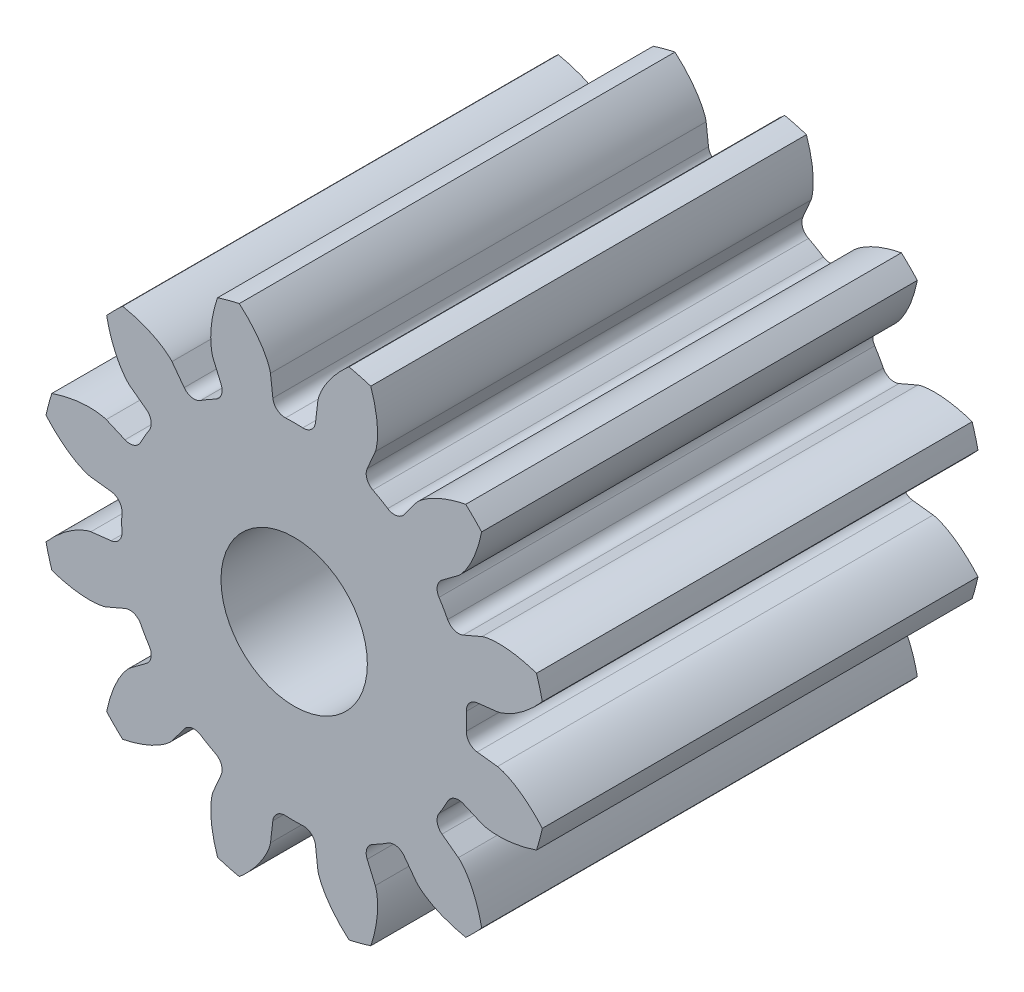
SolidWorks part; units mm, degrees
ref_plane "Front Plane" through (0, 0, 0) normal (0, 0, 1) x (1, 0, 0)
ref_plane "Top Plane" through (0, 0, 0) normal (0, 1, 0) x (1, 0, 0)
ref_plane "Right Plane" through (0, 0, 0) normal (1, 0, 0) x (0, 0, -1)
sketch "Sketch1" plane through (0, 0, 0) normal (0, 0, 1) x (1, 0, 0)
  line L0 (0, 0) -> (0, 6.35) construction
  line L1 (-2.0409, 7.0928) -> (2.0409, 5.6072) construction
  circle A0 centre (0, 0) radius 5.0271 construction
  circle A1 centre (0, 0) radius 7.4083 construction
  circle A2 centre (0, 0) radius 6.35 construction
  circle A3 centre (0, 0) radius 5.967 construction
  circle A4 centre (0, 0) radius 2.3813 construction
  circle A5 centre (0, 0) radius 4.826 construction
  point P8 (304.8, 0)
  point P13 (152.4, 0)
sketch "Sketch2" plane through (0, 0, 0) normal (1, 0, 0) x (0, 0, -1)
  line L0 (-6.35, 0) -> (6.35, 0) construction
  line L1 (-6.35, 7.4083) -> (6.35, 7.4083) construction
  point P2 (0, 7.4083)
  point P4 (0, 0)
  point P6 (0, 7.4083)
  dimension "Overall Width" = 12.7
  dimension "Hub Width" = 6.35
  dimension "Face Width" = 6.35
sketch "Sketch3" plane through (0, 0, 0) normal (0, 0, 1) x (1, 0, 0)
  circle A0 centre (0, 0) radius 7.4083
  circle A1 centre (0, 0) radius 7.4083 construction
extrude "Boss-Extrude1" add sketch "Sketch3" against normal up to vertex (6.35 mm away) and the other way up to vertex (6.35 mm away)
sketch "Sketch5" plane through (0, 0, 0) normal (1, 0, 0) x (0, 0, -1)
  line L1 (-6.35, 7.4083) -> (0, 7.4083)
  line L2 (-6.35, 7.4083) -> (-6.35, 4.826)
  line L3 (-6.35, 4.826) -> (0, 4.826)
  line L4 (0, 7.4083) -> (0, 4.826)
  line L11 (6.35, 2.3813) -> (-6.35, 2.3812)
  line L12 (6.35, 2.3813) -> (6.35, 0)
  line L13 (6.35, 0) -> (-6.35, 0)
  line L14 (-6.35, 2.3812) -> (-6.35, 0)
  point P5 (0, 2.3813)
  point P12 (0, 4.826)
revolve "Cut-Revolve1" cut sketch "Sketch5" angle 360 about L0
sketch "Sketch4" plane through (0, 0, 0) normal (0, 0, 1) x (1, 0, 0)
  line L0 (0, 0) -> (4.9933, 0.5818) construction
  line L2 (0, 0) -> (4.9933, -0.5818) construction
  line L4 (4.9933, 0.5818) -> (5.927, 0.6906)
  line L5 (5.927, -0.6906) -> (4.9933, -0.5818)
  arc A0 (4.9933, 0.5818) -> (4.9933, -0.5818) centre (0, 0) cw
  arc A3 (7.2339, 1.5983) -> (7.2339, -1.5983) centre (0, 0) cw
  circle A4 centre (0, 0) radius 7.4083 construction
  spline S0 degree 4 poles (5.927, 0.6906) (5.9293, 0.6909) (5.9359, 0.6919) (5.9484, 0.6942) (5.9686, 0.6987) (5.9942, 0.7052) (6.0271, 0.7148) (6.0655, 0.7275) (6.1073, 0.7428) (6.1523, 0.761) (6.1969, 0.7804) (6.2409, 0.8011) (6.2844, 0.8228) (6.3367, 0.8503) (6.3986, 0.8852) (6.47, 0.9285) (6.5497, 0.9807) (6.6294, 1.0371) (6.7066, 1.0952) (6.7832, 1.1568) (6.8562, 1.2185) (6.9304, 1.2856) (6.9981, 1.3489) (7.0721, 1.4232) (7.1312, 1.484) (7.2071, 1.5675) (7.2513, 1.6179) (7.3023, 1.6779) (7.3245, 1.7051) (7.3382, 1.7219) knots 0 0 0 0 0 0.005377 0.015084 0.028532 0.04661 0.064855 0.092111 0.119476 0.146842 0.174209 0.201575 0.228941 0.256307 0.307035 0.361767 0.4165 0.471232 0.525964 0.580697 0.635429 0.690161 0.744894 0.799626 0.854358 0.909091 0.954545 1 1 1 1 1 construction
  spline S1 degree 4 poles (5.927, 0.6906) (5.9293, 0.6909) (5.9359, 0.6919) (5.9484, 0.6942) (5.9686, 0.6987) (5.9942, 0.7052) (6.0271, 0.7148) (6.0655, 0.7275) (6.1073, 0.7428) (6.1523, 0.761) (6.1969, 0.7804) (6.2409, 0.8011) (6.2844, 0.8228) (6.3367, 0.8503) (6.3986, 0.8852) (6.47, 0.9285) (6.5497, 0.9807) (6.6294, 1.0371) (6.7066, 1.0952) (6.7832, 1.1568) (6.8562, 1.2185) (6.9304, 1.2856) (6.9981, 1.3489) (7.0721, 1.4232) (7.1312, 1.484) (7.1906, 1.5494) (7.2193, 1.5816) (7.2339, 1.5983) knots 0 0 0 0 0 0.005377 0.015084 0.028532 0.04661 0.064855 0.092111 0.119476 0.146842 0.174209 0.201575 0.228941 0.256307 0.307035 0.361767 0.4165 0.471232 0.525964 0.580697 0.635429 0.690161 0.744894 0.799626 0.854358 0.909091 0.909091 0.909091 0.909091 0.909091
  spline S2 degree 4 poles (5.927, -0.6906) (5.9293, -0.6909) (5.9359, -0.6919) (5.9484, -0.6942) (5.9686, -0.6987) (5.9942, -0.7052) (6.0271, -0.7148) (6.0655, -0.7275) (6.1073, -0.7428) (6.1523, -0.761) (6.1969, -0.7804) (6.2409, -0.8011) (6.2844, -0.8228) (6.3367, -0.8503) (6.3986, -0.8852) (6.47, -0.9285) (6.5497, -0.9807) (6.6294, -1.0371) (6.7066, -1.0952) (6.7832, -1.1568) (6.8562, -1.2185) (6.9304, -1.2856) (6.9981, -1.3489) (7.0721, -1.4232) (7.1312, -1.484) (7.2071, -1.5675) (7.2513, -1.6179) (7.3023, -1.6779) (7.3245, -1.7051) (7.3382, -1.7219) knots 0 0 0 0 0 0.005377 0.015084 0.028532 0.04661 0.064855 0.092111 0.119476 0.146842 0.174209 0.201575 0.228941 0.256307 0.307035 0.361767 0.4165 0.471232 0.525964 0.580697 0.635429 0.690161 0.744894 0.799626 0.854358 0.909091 0.954545 1 1 1 1 1 construction
  spline S3 degree 4 poles (5.927, -0.6906) (5.9293, -0.6909) (5.9359, -0.6919) (5.9484, -0.6942) (5.9686, -0.6987) (5.9942, -0.7052) (6.0271, -0.7148) (6.0655, -0.7275) (6.1073, -0.7428) (6.1523, -0.761) (6.1969, -0.7804) (6.2409, -0.8011) (6.2844, -0.8228) (6.3367, -0.8503) (6.3986, -0.8852) (6.47, -0.9285) (6.5497, -0.9807) (6.6294, -1.0371) (6.7066, -1.0952) (6.7832, -1.1568) (6.8562, -1.2185) (6.9304, -1.2856) (6.9981, -1.3489) (7.0721, -1.4232) (7.1312, -1.484) (7.1906, -1.5494) (7.2193, -1.5816) (7.2339, -1.5983) knots 0 0 0 0 0 0.005377 0.015084 0.028532 0.04661 0.064855 0.092111 0.119476 0.146842 0.174209 0.201575 0.228941 0.256307 0.307035 0.361767 0.4165 0.471232 0.525964 0.580697 0.635429 0.690161 0.744894 0.799626 0.854358 0.909091 0.909091 0.909091 0.909091 0.909091
extrude "Cut-Extrude1" cut sketch "Sketch4" against normal through all both and the other way through all
fillet "Fillet1" radius 0.3551 2 edges at (4.9933, -0.5818, -3.175) (4.9933, 0.5818, -3.175)
pattern_circular "CirPattern1" count 12 over 360 about axis through (0, 0, 6.35) along (0, 0, -1) of "Cut-Extrude1", "Fillet1"
sketch "Sketch6" plane through (0, 0, 6.35) normal (0, 0, 1) x (1, 0, 0)
  circle A0 centre (0, 0) radius 9.1604
extrude "Cut-Extrude2" cut sketch "Sketch6" against normal up to surface (6.35 mm away)
scale "Scale1" scale about centroid uniform scaling yes scale factor 1.5
sketch "Sketch13" plane through (0, 0, -7.9375) normal (0, 0, -1) x (-1, 0, 0)
  circle A0 centre (0, 0) radius 14.2875
  dimension "D1" = 28.575
sketch "Sketch14" plane through (0, 0, -7.9375) normal (0, 0, -1) x (-1, 0, 0)
  line L24 (-5.3423, -7.1814) -> (-4.8082, -6.4634)
  line L25 (-3.1933, -7.3957) -> (-3.5481, -8.2173)
  line L26 (-1.0359, -8.8904) -> (-0.9323, -8.0015)
  line L27 (0.9323, -8.0015) -> (1.0359, -8.8904)
  line L28 (3.5481, -8.2173) -> (3.1933, -7.3957)
  line L29 (4.8082, -6.4634) -> (5.3423, -7.1814)
  line L30 (7.1814, -5.3423) -> (6.4634, -4.8082)
  line L31 (7.3957, -3.1933) -> (8.2173, -3.5481)
  line L32 (8.8904, -1.0359) -> (8.0015, -0.9323)
  line L33 (8.0015, 0.9323) -> (8.8904, 1.0359)
  line L34 (8.2173, 3.5481) -> (7.3957, 3.1933)
  line L35 (6.4634, 4.8082) -> (7.1814, 5.3423)
  line L36 (5.3423, 7.1814) -> (4.8082, 6.4634)
  line L37 (3.1933, 7.3957) -> (3.5481, 8.2173)
  line L38 (1.0359, 8.8904) -> (0.9323, 8.0015)
  line L39 (-0.9323, 8.0015) -> (-1.0359, 8.8904)
  line L40 (-3.5481, 8.2173) -> (-3.1933, 7.3957)
  line L41 (-4.8082, 6.4634) -> (-5.3423, 7.1814)
  line L42 (-7.1814, 5.3423) -> (-6.4634, 4.8082)
  line L43 (-7.3957, 3.1933) -> (-8.2173, 3.5481)
  line L44 (-8.8904, 1.0359) -> (-8.0015, 0.9323)
  line L45 (-8.0015, -0.9323) -> (-8.8904, -1.0359)
  line L46 (-8.2173, -3.5481) -> (-7.3957, -3.1933)
  line L47 (-6.4634, -4.8082) -> (-7.1814, -5.3423)
  line L48 (-5.3423, -7.1814) -> (-4.8082, -6.4634)
  line L49 (-3.1933, -7.3957) -> (-3.5481, -8.2173)
  line L50 (-1.0359, -8.8904) -> (-0.9323, -8.0015)
  line L51 (0.9323, -8.0015) -> (1.0359, -8.8904)
  line L52 (3.5481, -8.2173) -> (3.1933, -7.3957)
  line L53 (4.8082, -6.4634) -> (5.3423, -7.1814)
  line L54 (7.1814, -5.3423) -> (6.4634, -4.8082)
  line L55 (7.3957, -3.1933) -> (8.2173, -3.5481)
  line L56 (8.8904, -1.0359) -> (8.0015, -0.9323)
  line L57 (8.0015, 0.9323) -> (8.8904, 1.0359)
  line L58 (8.2173, 3.5481) -> (7.3957, 3.1933)
  line L59 (6.4634, 4.8082) -> (7.1814, 5.3423)
  line L60 (5.3423, 7.1814) -> (4.8082, 6.4634)
  line L61 (3.1933, 7.3957) -> (3.5481, 8.2173)
  line L62 (1.0359, 8.8904) -> (0.9323, 8.0015)
  line L63 (-0.9323, 8.0015) -> (-1.0359, 8.8904)
  line L64 (-3.5481, 8.2173) -> (-3.1933, 7.3957)
  line L65 (-4.8082, 6.4634) -> (-5.3423, 7.1814)
  line L66 (-7.1814, 5.3423) -> (-6.4634, 4.8082)
  line L67 (-7.3957, 3.1933) -> (-8.2173, 3.5481)
  line L68 (-8.8904, 1.0359) -> (-8.0015, 0.9323)
  line L69 (-8.0015, -0.9323) -> (-8.8904, -1.0359)
  line L70 (-8.2173, -3.5481) -> (-7.3957, -3.1933)
  line L71 (-6.4634, -4.8082) -> (-7.1814, -5.3423)
  circle A0 centre (0, 0) radius 3.5719
  circle A1 centre (0, 0) radius 3.5719 construction
  arc A48 (-8.1984, -7.5016) -> (-7.5016, -8.1984) centre (0, 0) ccw
  arc A49 (-4.0918, -6.3339) -> (-4.8082, -6.4634) centre (-4.3808, -6.7813) ccw
  arc A50 (-4.0918, -6.3339) -> (-3.4394, -6.7106) centre (0, 0) ccw
  arc A51 (-3.1933, -7.3957) -> (-3.4394, -6.7106) centre (-3.6823, -7.1845) ccw
  arc A52 (-3.3492, -10.5958) -> (-2.3974, -10.8508) centre (0, 0) ccw
  arc A53 (-0.3767, -7.5312) -> (-0.9323, -8.0015) centre (-0.4033, -8.0632) ccw
  arc A54 (-0.3767, -7.5312) -> (0.3767, -7.5312) centre (0, 0) ccw
  arc A55 (0.9323, -8.0015) -> (0.3767, -7.5312) centre (0.4033, -8.0632) ccw
  arc A56 (2.3974, -10.8508) -> (3.3492, -10.5958) centre (0, 0) ccw
  arc A57 (3.4394, -6.7106) -> (3.1933, -7.3957) centre (3.6823, -7.1845) ccw
  arc A58 (3.4394, -6.7106) -> (4.0918, -6.3339) centre (0, 0) ccw
  arc A59 (4.8082, -6.4634) -> (4.0918, -6.3339) centre (4.3808, -6.7813) ccw
  arc A60 (7.5016, -8.1984) -> (8.1984, -7.5016) centre (0, 0) ccw
  arc A61 (6.3339, -4.0918) -> (6.4634, -4.8082) centre (6.7813, -4.3808) ccw
  arc A62 (6.3339, -4.0918) -> (6.7106, -3.4394) centre (0, 0) ccw
  arc A63 (7.3957, -3.1933) -> (6.7106, -3.4394) centre (7.1845, -3.6823) ccw
  arc A64 (10.5958, -3.3492) -> (10.8508, -2.3974) centre (0, 0) ccw
  arc A65 (7.5312, -0.3767) -> (8.0015, -0.9323) centre (8.0632, -0.4033) ccw
  arc A66 (7.5312, -0.3767) -> (7.5312, 0.3767) centre (0, 0) ccw
  arc A67 (8.0015, 0.9323) -> (7.5312, 0.3767) centre (8.0632, 0.4033) ccw
  arc A68 (10.8508, 2.3974) -> (10.5958, 3.3492) centre (0, 0) ccw
  arc A69 (6.7106, 3.4394) -> (7.3957, 3.1933) centre (7.1845, 3.6823) ccw
  arc A70 (6.7106, 3.4394) -> (6.3339, 4.0918) centre (0, 0) ccw
  arc A71 (6.4634, 4.8082) -> (6.3339, 4.0918) centre (6.7813, 4.3808) ccw
  arc A72 (8.1984, 7.5016) -> (7.5016, 8.1984) centre (0, 0) ccw
  arc A73 (4.0918, 6.3339) -> (4.8082, 6.4634) centre (4.3808, 6.7813) ccw
  arc A74 (4.0918, 6.3339) -> (3.4394, 6.7106) centre (0, 0) ccw
  arc A75 (3.1933, 7.3957) -> (3.4394, 6.7106) centre (3.6823, 7.1845) ccw
  arc A76 (3.3492, 10.5958) -> (2.3974, 10.8508) centre (0, 0) ccw
  arc A77 (0.3767, 7.5312) -> (0.9323, 8.0015) centre (0.4033, 8.0632) ccw
  arc A78 (0.3767, 7.5312) -> (-0.3767, 7.5312) centre (0, 0) ccw
  arc A79 (-0.9323, 8.0015) -> (-0.3767, 7.5312) centre (-0.4033, 8.0632) ccw
  arc A80 (-2.3974, 10.8508) -> (-3.3492, 10.5958) centre (0, 0) ccw
  arc A81 (-3.4394, 6.7106) -> (-3.1933, 7.3957) centre (-3.6823, 7.1845) ccw
  arc A82 (-3.4394, 6.7106) -> (-4.0918, 6.3339) centre (0, 0) ccw
  arc A83 (-4.8082, 6.4634) -> (-4.0918, 6.3339) centre (-4.3808, 6.7813) ccw
  arc A84 (-7.5016, 8.1984) -> (-8.1984, 7.5016) centre (0, 0) ccw
  arc A85 (-6.3339, 4.0918) -> (-6.4634, 4.8082) centre (-6.7813, 4.3808) ccw
  arc A86 (-6.3339, 4.0918) -> (-6.7106, 3.4394) centre (0, 0) ccw
  arc A87 (-7.3957, 3.1933) -> (-6.7106, 3.4394) centre (-7.1845, 3.6823) ccw
  arc A88 (-10.5958, 3.3492) -> (-10.8508, 2.3974) centre (0, 0) ccw
  arc A89 (-7.5312, 0.3767) -> (-8.0015, 0.9323) centre (-8.0632, 0.4033) ccw
  arc A90 (-7.5312, 0.3767) -> (-7.5312, -0.3767) centre (0, 0) ccw
  arc A91 (-8.0015, -0.9323) -> (-7.5312, -0.3767) centre (-8.0632, -0.4033) ccw
  arc A92 (-10.8508, -2.3974) -> (-10.5958, -3.3492) centre (0, 0) ccw
  arc A93 (-6.7106, -3.4394) -> (-7.3957, -3.1933) centre (-7.1845, -3.6823) ccw
  arc A94 (-6.7106, -3.4394) -> (-6.3339, -4.0918) centre (0, 0) ccw
  arc A95 (-6.4634, -4.8082) -> (-6.3339, -4.0918) centre (-6.7813, -4.3808) ccw
  arc A96 (-8.1984, -7.5016) -> (-7.5016, -8.1984) centre (0, 0) ccw
  arc A97 (-4.0918, -6.3339) -> (-4.8082, -6.4634) centre (-4.3808, -6.7813) ccw
  arc A98 (-4.0918, -6.3339) -> (-3.4394, -6.7106) centre (0, 0) ccw
  arc A99 (-3.1933, -7.3957) -> (-3.4394, -6.7106) centre (-3.6823, -7.1845) ccw
  arc A100 (-3.3492, -10.5958) -> (-2.3974, -10.8508) centre (0, 0) ccw
  arc A101 (-0.3767, -7.5312) -> (-0.9323, -8.0015) centre (-0.4033, -8.0632) ccw
  arc A102 (-0.3767, -7.5312) -> (0.3767, -7.5312) centre (0, 0) ccw
  arc A103 (0.9323, -8.0015) -> (0.3767, -7.5312) centre (0.4033, -8.0632) ccw
  arc A104 (2.3974, -10.8508) -> (3.3492, -10.5958) centre (0, 0) ccw
  arc A105 (3.4394, -6.7106) -> (3.1933, -7.3957) centre (3.6823, -7.1845) ccw
  arc A106 (3.4394, -6.7106) -> (4.0918, -6.3339) centre (0, 0) ccw
  arc A107 (4.8082, -6.4634) -> (4.0918, -6.3339) centre (4.3808, -6.7813) ccw
  arc A108 (7.5016, -8.1984) -> (8.1984, -7.5016) centre (0, 0) ccw
  arc A109 (6.3339, -4.0918) -> (6.4634, -4.8082) centre (6.7813, -4.3808) ccw
  arc A110 (6.3339, -4.0918) -> (6.7106, -3.4394) centre (0, 0) ccw
  arc A111 (7.3957, -3.1933) -> (6.7106, -3.4394) centre (7.1845, -3.6823) ccw
  arc A112 (10.5958, -3.3492) -> (10.8508, -2.3974) centre (0, 0) ccw
  arc A113 (7.5312, -0.3767) -> (8.0015, -0.9323) centre (8.0632, -0.4033) ccw
  arc A114 (7.5312, -0.3767) -> (7.5312, 0.3767) centre (0, 0) ccw
  arc A115 (8.0015, 0.9323) -> (7.5312, 0.3767) centre (8.0632, 0.4033) ccw
  arc A116 (10.8508, 2.3974) -> (10.5958, 3.3492) centre (0, 0) ccw
  arc A117 (6.7106, 3.4394) -> (7.3957, 3.1933) centre (7.1845, 3.6823) ccw
  arc A118 (6.7106, 3.4394) -> (6.3339, 4.0918) centre (0, 0) ccw
  arc A119 (6.4634, 4.8082) -> (6.3339, 4.0918) centre (6.7813, 4.3808) ccw
  arc A120 (8.1984, 7.5016) -> (7.5016, 8.1984) centre (0, 0) ccw
  arc A121 (4.0918, 6.3339) -> (4.8082, 6.4634) centre (4.3808, 6.7813) ccw
  arc A122 (4.0918, 6.3339) -> (3.4394, 6.7106) centre (0, 0) ccw
  arc A123 (3.1933, 7.3957) -> (3.4394, 6.7106) centre (3.6823, 7.1845) ccw
  arc A124 (3.3492, 10.5958) -> (2.3974, 10.8508) centre (0, 0) ccw
  arc A125 (0.3767, 7.5312) -> (0.9323, 8.0015) centre (0.4033, 8.0632) ccw
  arc A126 (0.3767, 7.5312) -> (-0.3767, 7.5312) centre (0, 0) ccw
  arc A127 (-0.9323, 8.0015) -> (-0.3767, 7.5312) centre (-0.4033, 8.0632) ccw
  arc A128 (-2.3974, 10.8508) -> (-3.3492, 10.5958) centre (0, 0) ccw
  arc A129 (-3.4394, 6.7106) -> (-3.1933, 7.3957) centre (-3.6823, 7.1845) ccw
  arc A130 (-3.4394, 6.7106) -> (-4.0918, 6.3339) centre (0, 0) ccw
  arc A131 (-4.8082, 6.4634) -> (-4.0918, 6.3339) centre (-4.3808, 6.7813) ccw
  arc A132 (-7.5016, 8.1984) -> (-8.1984, 7.5016) centre (0, 0) ccw
  arc A133 (-6.3339, 4.0918) -> (-6.4634, 4.8082) centre (-6.7813, 4.3808) ccw
  arc A134 (-6.3339, 4.0918) -> (-6.7106, 3.4394) centre (0, 0) ccw
  arc A135 (-7.3957, 3.1933) -> (-6.7106, 3.4394) centre (-7.1845, 3.6823) ccw
  arc A136 (-10.5958, 3.3492) -> (-10.8508, 2.3974) centre (0, 0) ccw
  arc A137 (-7.5312, 0.3767) -> (-8.0015, 0.9323) centre (-8.0632, 0.4033) ccw
  arc A138 (-7.5312, 0.3767) -> (-7.5312, -0.3767) centre (0, 0) ccw
  arc A139 (-8.0015, -0.9323) -> (-7.5312, -0.3767) centre (-8.0632, -0.4033) ccw
  arc A140 (-10.8508, -2.3974) -> (-10.5958, -3.3492) centre (0, 0) ccw
  arc A141 (-6.7106, -3.4394) -> (-7.3957, -3.1933) centre (-7.1845, -3.6823) ccw
  arc A142 (-6.7106, -3.4394) -> (-6.3339, -4.0918) centre (0, 0) ccw
  arc A143 (-6.4634, -4.8082) -> (-6.3339, -4.0918) centre (-6.7813, -4.3808) ccw
  spline S24 degree 4 poles (-2950.3771, -589.9369) (50.7356, 3.6642) (-11.2792, -8.8437) (-7.9522, -8.3216) (-7.1528, -8.1195) (-7.0009, -8.0791) (-6.8678, -8.0387) (-6.7251, -7.9926) (-6.5901, -7.944) (-6.4527, -7.8908) (-6.3193, -7.834) (-6.1862, -7.7727) (-6.0587, -7.7084) (-5.9489, -7.6481) (-5.8571, -7.5938) (-5.7821, -7.5467) (-5.7213, -7.5064) (-5.6615, -7.4647) (-5.6028, -7.4214) (-5.5454, -7.3765) (-5.4941, -7.3337) (-5.4489, -7.2933) (-5.4118, -7.2578) (-5.3841, -7.2295) (-5.0204, -6.8307) (-5.0047, -6.1356) (-26.8856, 10.8045) (-2387.5552, 1816.0789) knots -1.19985 -1.19985 -1.19985 -1.19985 -1.19985 0.054733 0.109465 0.164197 0.21893 0.273662 0.328394 0.383127 0.437859 0.492591 0.547324 0.602056 0.652784 0.68015 0.707516 0.734882 0.762248 0.789615 0.81698 0.844236 0.862481 0.880559 0.894007 0.903714 1.672385 1.672385 1.672385 1.672385 1.672385 only from (-7.5016, -8.1984) to (-5.3423, -7.1814)
  spline S25 degree 4 poles (2766.4875, -1159.6188) (22.7994, -17.8812) (-2.8112, -7.402) (-3.4054, -7.7631) (-3.5689, -8.2775) (-3.5795, -8.3157) (-3.5917, -8.3655) (-3.6041, -8.4249) (-3.6156, -8.4907) (-3.6258, -8.5628) (-3.6339, -8.6353) (-3.6401, -8.708) (-3.6445, -8.7808) (-3.6479, -8.8693) (-3.6491, -8.9759) (-3.6463, -9.1012) (-3.6383, -9.2438) (-3.6248, -9.3897) (-3.6073, -9.5336) (-3.5847, -9.6792) (-3.5593, -9.8204) (-3.5278, -9.9671) (-3.4963, -10.1025) (-3.4553, -10.2542) (-3.2307, -11.0476) (-2.0193, -14.1899) (-22.1946, 45.7707) (964.2953, -2850.0908) knots -0.76329 -0.76329 -0.76329 -0.76329 -0.76329 0.005377 0.015084 0.028532 0.04661 0.064855 0.092111 0.119476 0.146842 0.174209 0.201575 0.228941 0.256307 0.307035 0.361767 0.4165 0.471232 0.525964 0.580697 0.635429 0.690161 0.744894 0.799626 0.854358 2.108943 2.108943 2.108943 2.108943 2.108943 only from (-3.5481, -8.2173) to (-3.3492, -10.5958)
  spline S26 degree 4 poles (-2260.1331, -1986.0888) (42.1062, 28.5411) (-5.3462, -13.2985) (-2.726, -11.1828) (-2.1347, -10.6081) (-2.0234, -10.4972) (-1.9283, -10.3956) (-1.8278, -10.2843) (-1.7352, -10.1748) (-1.6428, -10.06) (-1.5556, -9.9441) (-1.4711, -9.8245) (-1.3928, -9.705) (-1.3278, -9.5979) (-1.2755, -9.505) (-1.2342, -9.4267) (-1.2016, -9.3614) (-1.1706, -9.2953) (-1.1414, -9.2285) (-1.1142, -9.1609) (-1.0912, -9.0982) (-1.0722, -9.0406) (-1.0579, -8.9913) (-1.048, -8.953) (-0.9324, -8.4258) (-1.2664, -7.8159) (-28.6859, -4.0858) (-2975.7229, 378.9928) knots -1.19985 -1.19985 -1.19985 -1.19985 -1.19985 0.054733 0.109465 0.164197 0.21893 0.273662 0.328394 0.383127 0.437859 0.492591 0.547324 0.602056 0.652784 0.68015 0.707516 0.734882 0.762248 0.789615 0.81698 0.844236 0.862481 0.880559 0.894007 0.903714 1.672385 1.672385 1.672385 1.672385 1.672385 only from (-2.3974, -10.8508) to (-1.0359, -8.8904)
  spline S27 degree 4 poles (2975.6578, 378.9844) (28.6854, -4.0859) (1.2664, -7.8159) (0.9324, -8.4258) (1.048, -8.953) (1.0579, -8.9913) (1.0722, -9.0406) (1.0912, -9.0982) (1.1142, -9.1609) (1.1414, -9.2285) (1.1706, -9.2953) (1.2016, -9.3614) (1.2342, -9.4267) (1.2755, -9.505) (1.3278, -9.5979) (1.3928, -9.705) (1.4711, -9.8245) (1.5556, -9.9441) (1.6428, -10.06) (1.7352, -10.1748) (1.8278, -10.2843) (1.9283, -10.3956) (2.0234, -10.4972) (2.1347, -10.6081) (2.726, -11.1828) (5.3462, -13.2985) (-42.1065, 28.5413) (2260.1496, -1986.1034) knots -0.76329 -0.76329 -0.76329 -0.76329 -0.76329 0.005377 0.015084 0.028532 0.04661 0.064855 0.092111 0.119476 0.146842 0.174209 0.201575 0.228941 0.256307 0.307035 0.361767 0.4165 0.471232 0.525964 0.580697 0.635429 0.690161 0.744894 0.799626 0.854358 2.108943 2.108943 2.108943 2.108943 2.108943 only from (1.0359, -8.8904) to (2.3974, -10.8508)
  spline S28 degree 4 poles (-964.2882, -2850.0699) (22.1945, 45.7704) (2.0193, -14.1899) (3.2307, -11.0476) (3.4553, -10.2542) (3.4963, -10.1025) (3.5278, -9.9671) (3.5593, -9.8204) (3.5847, -9.6792) (3.6073, -9.5336) (3.6248, -9.3897) (3.6383, -9.2438) (3.6463, -9.1012) (3.6491, -8.9759) (3.6479, -8.8693) (3.6445, -8.7808) (3.6401, -8.708) (3.6339, -8.6353) (3.6258, -8.5628) (3.6156, -8.4907) (3.6041, -8.4249) (3.5917, -8.3655) (3.5795, -8.3157) (3.5689, -8.2775) (3.4054, -7.7631) (2.8112, -7.402) (-22.7998, -17.8814) (-2766.5481, -1159.644) knots -1.19985 -1.19985 -1.19985 -1.19985 -1.19985 0.054733 0.109465 0.164197 0.21893 0.273662 0.328394 0.383127 0.437859 0.492591 0.547324 0.602056 0.652784 0.68015 0.707516 0.734882 0.762248 0.789615 0.81698 0.844236 0.862481 0.880559 0.894007 0.903714 1.672385 1.672385 1.672385 1.672385 1.672385 only from (3.3492, -10.5958) to (3.5481, -8.2173)
  spline S29 degree 4 poles (2387.5031, 1816.039) (26.8853, 10.8042) (5.0047, -6.1356) (5.0204, -6.8307) (5.3841, -7.2295) (5.4118, -7.2578) (5.4489, -7.2933) (5.4941, -7.3337) (5.5454, -7.3765) (5.6028, -7.4214) (5.6615, -7.4647) (5.7213, -7.5064) (5.7821, -7.5467) (5.8571, -7.5938) (5.9489, -7.6481) (6.0587, -7.7084) (6.1862, -7.7727) (6.3193, -7.834) (6.4527, -7.8908) (6.5901, -7.944) (6.7251, -7.9926) (6.8678, -8.0387) (7.0009, -8.0791) (7.1528, -8.1195) (7.9522, -8.3216) (11.2792, -8.8437) (-50.7359, 3.6643) (2950.3987, -589.9411) knots -0.76329 -0.76329 -0.76329 -0.76329 -0.76329 0.005377 0.015084 0.028532 0.04661 0.064855 0.092111 0.119476 0.146842 0.174209 0.201575 0.228941 0.256307 0.307035 0.361767 0.4165 0.471232 0.525964 0.580697 0.635429 0.690161 0.744894 0.799626 0.854358 2.108943 2.108943 2.108943 2.108943 2.108943 only from (5.3423, -7.1814) to (7.5016, -8.1984)
  spline S30 degree 4 poles (589.9369, -2950.3771) (-3.6642, 50.7356) (8.8437, -11.2792) (8.3216, -7.9522) (8.1195, -7.1528) (8.0791, -7.0009) (8.0387, -6.8678) (7.9926, -6.7251) (7.944, -6.5901) (7.8908, -6.4527) (7.834, -6.3193) (7.7727, -6.1862) (7.7084, -6.0587) (7.6481, -5.9489) (7.5938, -5.8571) (7.5467, -5.7821) (7.5064, -5.7213) (7.4647, -5.6615) (7.4214, -5.6028) (7.3765, -5.5454) (7.3337, -5.4941) (7.2933, -5.4489) (7.2578, -5.4118) (7.2295, -5.3841) (6.8307, -5.0204) (6.1356, -5.0047) (-10.8045, -26.8856) (-1816.0789, -2387.5552) knots -1.19985 -1.19985 -1.19985 -1.19985 -1.19985 0.054733 0.109465 0.164197 0.21893 0.273662 0.328394 0.383127 0.437859 0.492591 0.547324 0.602056 0.652784 0.68015 0.707516 0.734882 0.762248 0.789615 0.81698 0.844236 0.862481 0.880559 0.894007 0.903714 1.672385 1.672385 1.672385 1.672385 1.672385 only from (8.1984, -7.5016) to (7.1814, -5.3423)
  spline S31 degree 4 poles (1159.6188, 2766.4875) (17.8812, 22.7994) (7.402, -2.8112) (7.7631, -3.4054) (8.2775, -3.5689) (8.3157, -3.5795) (8.3655, -3.5917) (8.4249, -3.6041) (8.4907, -3.6156) (8.5628, -3.6258) (8.6353, -3.6339) (8.708, -3.6401) (8.7808, -3.6445) (8.8693, -3.6479) (8.9759, -3.6491) (9.1012, -3.6463) (9.2438, -3.6383) (9.3897, -3.6248) (9.5336, -3.6073) (9.6792, -3.5847) (9.8204, -3.5593) (9.9671, -3.5278) (10.1025, -3.4963) (10.2542, -3.4553) (11.0476, -3.2307) (14.1899, -2.0193) (-45.7707, -22.1946) (2850.0908, 964.2953) knots -0.76329 -0.76329 -0.76329 -0.76329 -0.76329 0.005377 0.015084 0.028532 0.04661 0.064855 0.092111 0.119476 0.146842 0.174209 0.201575 0.228941 0.256307 0.307035 0.361767 0.4165 0.471232 0.525964 0.580697 0.635429 0.690161 0.744894 0.799626 0.854358 2.108943 2.108943 2.108943 2.108943 2.108943 only from (8.2173, -3.5481) to (10.5958, -3.3492)
  spline S32 degree 4 poles (1986.0888, -2260.1331) (-28.5411, 42.1062) (13.2985, -5.3462) (11.1828, -2.726) (10.6081, -2.1347) (10.4972, -2.0234) (10.3956, -1.9283) (10.2843, -1.8278) (10.1748, -1.7352) (10.06, -1.6428) (9.9441, -1.5556) (9.8245, -1.4711) (9.705, -1.3928) (9.5979, -1.3278) (9.505, -1.2755) (9.4267, -1.2342) (9.3614, -1.2016) (9.2953, -1.1706) (9.2285, -1.1414) (9.1609, -1.1142) (9.0982, -1.0912) (9.0406, -1.0722) (8.9913, -1.0579) (8.953, -1.048) (8.4258, -0.9324) (7.8159, -1.2664) (4.0858, -28.6859) (-378.9928, -2975.7229) knots -1.19985 -1.19985 -1.19985 -1.19985 -1.19985 0.054733 0.109465 0.164197 0.21893 0.273662 0.328394 0.383127 0.437859 0.492591 0.547324 0.602056 0.652784 0.68015 0.707516 0.734882 0.762248 0.789615 0.81698 0.844236 0.862481 0.880559 0.894007 0.903714 1.672385 1.672385 1.672385 1.672385 1.672385 only from (10.8508, -2.3974) to (8.8904, -1.0359)
  spline S33 degree 4 poles (-378.9844, 2975.6578) (4.0859, 28.6854) (7.8159, 1.2664) (8.4258, 0.9324) (8.953, 1.048) (8.9913, 1.0579) (9.0406, 1.0722) (9.0982, 1.0912) (9.1609, 1.1142) (9.2285, 1.1414) (9.2953, 1.1706) (9.3614, 1.2016) (9.4267, 1.2342) (9.505, 1.2755) (9.5979, 1.3278) (9.705, 1.3928) (9.8245, 1.4711) (9.9441, 1.5556) (10.06, 1.6428) (10.1748, 1.7352) (10.2843, 1.8278) (10.3956, 1.9283) (10.4972, 2.0234) (10.6081, 2.1347) (11.1828, 2.726) (13.2985, 5.3462) (-28.5413, -42.1065) (1986.1034, 2260.1496) knots -0.76329 -0.76329 -0.76329 -0.76329 -0.76329 0.005377 0.015084 0.028532 0.04661 0.064855 0.092111 0.119476 0.146842 0.174209 0.201575 0.228941 0.256307 0.307035 0.361767 0.4165 0.471232 0.525964 0.580697 0.635429 0.690161 0.744894 0.799626 0.854358 2.108943 2.108943 2.108943 2.108943 2.108943 only from (8.8904, 1.0359) to (10.8508, 2.3974)
  spline S34 degree 4 poles (2850.0699, -964.2882) (-45.7704, 22.1945) (14.1899, 2.0193) (11.0476, 3.2307) (10.2542, 3.4553) (10.1025, 3.4963) (9.9671, 3.5278) (9.8204, 3.5593) (9.6792, 3.5847) (9.5336, 3.6073) (9.3897, 3.6248) (9.2438, 3.6383) (9.1012, 3.6463) (8.9759, 3.6491) (8.8693, 3.6479) (8.7808, 3.6445) (8.708, 3.6401) (8.6353, 3.6339) (8.5628, 3.6258) (8.4907, 3.6156) (8.4249, 3.6041) (8.3655, 3.5917) (8.3157, 3.5795) (8.2775, 3.5689) (7.7631, 3.4054) (7.402, 2.8112) (17.8814, -22.7998) (1159.644, -2766.5481) knots -1.19985 -1.19985 -1.19985 -1.19985 -1.19985 0.054733 0.109465 0.164197 0.21893 0.273662 0.328394 0.383127 0.437859 0.492591 0.547324 0.602056 0.652784 0.68015 0.707516 0.734882 0.762248 0.789615 0.81698 0.844236 0.862481 0.880559 0.894007 0.903714 1.672385 1.672385 1.672385 1.672385 1.672385 only from (10.5958, 3.3492) to (8.2173, 3.5481)
  spline S35 degree 4 poles (-1816.039, 2387.5031) (-10.8042, 26.8853) (6.1356, 5.0047) (6.8307, 5.0204) (7.2295, 5.3841) (7.2578, 5.4118) (7.2933, 5.4489) (7.3337, 5.4941) (7.3765, 5.5454) (7.4214, 5.6028) (7.4647, 5.6615) (7.5064, 5.7213) (7.5467, 5.7821) (7.5938, 5.8571) (7.6481, 5.9489) (7.7084, 6.0587) (7.7727, 6.1862) (7.834, 6.3193) (7.8908, 6.4527) (7.944, 6.5901) (7.9926, 6.7251) (8.0387, 6.8678) (8.0791, 7.0009) (8.1195, 7.1528) (8.3216, 7.9522) (8.8437, 11.2792) (-3.6643, -50.7359) (589.9411, 2950.3987) knots -0.76329 -0.76329 -0.76329 -0.76329 -0.76329 0.005377 0.015084 0.028532 0.04661 0.064855 0.092111 0.119476 0.146842 0.174209 0.201575 0.228941 0.256307 0.307035 0.361767 0.4165 0.471232 0.525964 0.580697 0.635429 0.690161 0.744894 0.799626 0.854358 2.108943 2.108943 2.108943 2.108943 2.108943 only from (7.1814, 5.3423) to (8.1984, 7.5016)
  spline S36 degree 4 poles (2950.3771, 589.9369) (-50.7356, -3.6642) (11.2792, 8.8437) (7.9522, 8.3216) (7.1528, 8.1195) (7.0009, 8.0791) (6.8678, 8.0387) (6.7251, 7.9926) (6.5901, 7.944) (6.4527, 7.8908) (6.3193, 7.834) (6.1862, 7.7727) (6.0587, 7.7084) (5.9489, 7.6481) (5.8571, 7.5938) (5.7821, 7.5467) (5.7213, 7.5064) (5.6615, 7.4647) (5.6028, 7.4214) (5.5454, 7.3765) (5.4941, 7.3337) (5.4489, 7.2933) (5.4118, 7.2578) (5.3841, 7.2295) (5.0204, 6.8307) (5.0047, 6.1356) (26.8856, -10.8045) (2387.5552, -1816.0789) knots -1.19985 -1.19985 -1.19985 -1.19985 -1.19985 0.054733 0.109465 0.164197 0.21893 0.273662 0.328394 0.383127 0.437859 0.492591 0.547324 0.602056 0.652784 0.68015 0.707516 0.734882 0.762248 0.789615 0.81698 0.844236 0.862481 0.880559 0.894007 0.903714 1.672385 1.672385 1.672385 1.672385 1.672385 only from (7.5016, 8.1984) to (5.3423, 7.1814)
  spline S37 degree 4 poles (-2766.4875, 1159.6188) (-22.7994, 17.8812) (2.8112, 7.402) (3.4054, 7.7631) (3.5689, 8.2775) (3.5795, 8.3157) (3.5917, 8.3655) (3.6041, 8.4249) (3.6156, 8.4907) (3.6258, 8.5628) (3.6339, 8.6353) (3.6401, 8.708) (3.6445, 8.7808) (3.6479, 8.8693) (3.6491, 8.9759) (3.6463, 9.1012) (3.6383, 9.2438) (3.6248, 9.3897) (3.6073, 9.5336) (3.5847, 9.6792) (3.5593, 9.8204) (3.5278, 9.9671) (3.4963, 10.1025) (3.4553, 10.2542) (3.2307, 11.0476) (2.0193, 14.1899) (22.1946, -45.7707) (-964.2953, 2850.0908) knots -0.76329 -0.76329 -0.76329 -0.76329 -0.76329 0.005377 0.015084 0.028532 0.04661 0.064855 0.092111 0.119476 0.146842 0.174209 0.201575 0.228941 0.256307 0.307035 0.361767 0.4165 0.471232 0.525964 0.580697 0.635429 0.690161 0.744894 0.799626 0.854358 2.108943 2.108943 2.108943 2.108943 2.108943 only from (3.5481, 8.2173) to (3.3492, 10.5958)
  spline S38 degree 4 poles (2260.1331, 1986.0888) (-42.1062, -28.5411) (5.3462, 13.2985) (2.726, 11.1828) (2.1347, 10.6081) (2.0234, 10.4972) (1.9283, 10.3956) (1.8278, 10.2843) (1.7352, 10.1748) (1.6428, 10.06) (1.5556, 9.9441) (1.4711, 9.8245) (1.3928, 9.705) (1.3278, 9.5979) (1.2755, 9.505) (1.2342, 9.4267) (1.2016, 9.3614) (1.1706, 9.2953) (1.1414, 9.2285) (1.1142, 9.1609) (1.0912, 9.0982) (1.0722, 9.0406) (1.0579, 8.9913) (1.048, 8.953) (0.9324, 8.4258) (1.2664, 7.8159) (28.6859, 4.0858) (2975.7229, -378.9928) knots -1.19985 -1.19985 -1.19985 -1.19985 -1.19985 0.054733 0.109465 0.164197 0.21893 0.273662 0.328394 0.383127 0.437859 0.492591 0.547324 0.602056 0.652784 0.68015 0.707516 0.734882 0.762248 0.789615 0.81698 0.844236 0.862481 0.880559 0.894007 0.903714 1.672385 1.672385 1.672385 1.672385 1.672385 only from (2.3974, 10.8508) to (1.0359, 8.8904)
  spline S39 degree 4 poles (-2975.6578, -378.9844) (-28.6854, 4.0859) (-1.2664, 7.8159) (-0.9324, 8.4258) (-1.048, 8.953) (-1.0579, 8.9913) (-1.0722, 9.0406) (-1.0912, 9.0982) (-1.1142, 9.1609) (-1.1414, 9.2285) (-1.1706, 9.2953) (-1.2016, 9.3614) (-1.2342, 9.4267) (-1.2755, 9.505) (-1.3278, 9.5979) (-1.3928, 9.705) (-1.4711, 9.8245) (-1.5556, 9.9441) (-1.6428, 10.06) (-1.7352, 10.1748) (-1.8278, 10.2843) (-1.9283, 10.3956) (-2.0234, 10.4972) (-2.1347, 10.6081) (-2.726, 11.1828) (-5.3462, 13.2985) (42.1065, -28.5413) (-2260.1496, 1986.1034) knots -0.76329 -0.76329 -0.76329 -0.76329 -0.76329 0.005377 0.015084 0.028532 0.04661 0.064855 0.092111 0.119476 0.146842 0.174209 0.201575 0.228941 0.256307 0.307035 0.361767 0.4165 0.471232 0.525964 0.580697 0.635429 0.690161 0.744894 0.799626 0.854358 2.108943 2.108943 2.108943 2.108943 2.108943 only from (-1.0359, 8.8904) to (-2.3974, 10.8508)
  spline S40 degree 4 poles (964.2882, 2850.0699) (-22.1945, -45.7704) (-2.0193, 14.1899) (-3.2307, 11.0476) (-3.4553, 10.2542) (-3.4963, 10.1025) (-3.5278, 9.9671) (-3.5593, 9.8204) (-3.5847, 9.6792) (-3.6073, 9.5336) (-3.6248, 9.3897) (-3.6383, 9.2438) (-3.6463, 9.1012) (-3.6491, 8.9759) (-3.6479, 8.8693) (-3.6445, 8.7808) (-3.6401, 8.708) (-3.6339, 8.6353) (-3.6258, 8.5628) (-3.6156, 8.4907) (-3.6041, 8.4249) (-3.5917, 8.3655) (-3.5795, 8.3157) (-3.5689, 8.2775) (-3.4054, 7.7631) (-2.8112, 7.402) (22.7998, 17.8814) (2766.5481, 1159.644) knots -1.19985 -1.19985 -1.19985 -1.19985 -1.19985 0.054733 0.109465 0.164197 0.21893 0.273662 0.328394 0.383127 0.437859 0.492591 0.547324 0.602056 0.652784 0.68015 0.707516 0.734882 0.762248 0.789615 0.81698 0.844236 0.862481 0.880559 0.894007 0.903714 1.672385 1.672385 1.672385 1.672385 1.672385 only from (-3.3492, 10.5958) to (-3.5481, 8.2173)
  spline S41 degree 4 poles (-2387.5031, -1816.039) (-26.8853, -10.8042) (-5.0047, 6.1356) (-5.0204, 6.8307) (-5.3841, 7.2295) (-5.4118, 7.2578) (-5.4489, 7.2933) (-5.4941, 7.3337) (-5.5454, 7.3765) (-5.6028, 7.4214) (-5.6615, 7.4647) (-5.7213, 7.5064) (-5.7821, 7.5467) (-5.8571, 7.5938) (-5.9489, 7.6481) (-6.0587, 7.7084) (-6.1862, 7.7727) (-6.3193, 7.834) (-6.4527, 7.8908) (-6.5901, 7.944) (-6.7251, 7.9926) (-6.8678, 8.0387) (-7.0009, 8.0791) (-7.1528, 8.1195) (-7.9522, 8.3216) (-11.2792, 8.8437) (50.7359, -3.6643) (-2950.3987, 589.9411) knots -0.76329 -0.76329 -0.76329 -0.76329 -0.76329 0.005377 0.015084 0.028532 0.04661 0.064855 0.092111 0.119476 0.146842 0.174209 0.201575 0.228941 0.256307 0.307035 0.361767 0.4165 0.471232 0.525964 0.580697 0.635429 0.690161 0.744894 0.799626 0.854358 2.108943 2.108943 2.108943 2.108943 2.108943 only from (-5.3423, 7.1814) to (-7.5016, 8.1984)
  spline S42 degree 4 poles (-589.9369, 2950.3771) (3.6642, -50.7356) (-8.8437, 11.2792) (-8.3216, 7.9522) (-8.1195, 7.1528) (-8.0791, 7.0009) (-8.0387, 6.8678) (-7.9926, 6.7251) (-7.944, 6.5901) (-7.8908, 6.4527) (-7.834, 6.3193) (-7.7727, 6.1862) (-7.7084, 6.0587) (-7.6481, 5.9489) (-7.5938, 5.8571) (-7.5467, 5.7821) (-7.5064, 5.7213) (-7.4647, 5.6615) (-7.4214, 5.6028) (-7.3765, 5.5454) (-7.3337, 5.4941) (-7.2933, 5.4489) (-7.2578, 5.4118) (-7.2295, 5.3841) (-6.8307, 5.0204) (-6.1356, 5.0047) (10.8045, 26.8856) (1816.0789, 2387.5552) knots -1.19985 -1.19985 -1.19985 -1.19985 -1.19985 0.054733 0.109465 0.164197 0.21893 0.273662 0.328394 0.383127 0.437859 0.492591 0.547324 0.602056 0.652784 0.68015 0.707516 0.734882 0.762248 0.789615 0.81698 0.844236 0.862481 0.880559 0.894007 0.903714 1.672385 1.672385 1.672385 1.672385 1.672385 only from (-8.1984, 7.5016) to (-7.1814, 5.3423)
  spline S43 degree 4 poles (-1159.6188, -2766.4875) (-17.8812, -22.7994) (-7.402, 2.8112) (-7.7631, 3.4054) (-8.2775, 3.5689) (-8.3157, 3.5795) (-8.3655, 3.5917) (-8.4249, 3.6041) (-8.4907, 3.6156) (-8.5628, 3.6258) (-8.6353, 3.6339) (-8.708, 3.6401) (-8.7808, 3.6445) (-8.8693, 3.6479) (-8.9759, 3.6491) (-9.1012, 3.6463) (-9.2438, 3.6383) (-9.3897, 3.6248) (-9.5336, 3.6073) (-9.6792, 3.5847) (-9.8204, 3.5593) (-9.9671, 3.5278) (-10.1025, 3.4963) (-10.2542, 3.4553) (-11.0476, 3.2307) (-14.1899, 2.0193) (45.7707, 22.1946) (-2850.0908, -964.2953) knots -0.76329 -0.76329 -0.76329 -0.76329 -0.76329 0.005377 0.015084 0.028532 0.04661 0.064855 0.092111 0.119476 0.146842 0.174209 0.201575 0.228941 0.256307 0.307035 0.361767 0.4165 0.471232 0.525964 0.580697 0.635429 0.690161 0.744894 0.799626 0.854358 2.108943 2.108943 2.108943 2.108943 2.108943 only from (-8.2173, 3.5481) to (-10.5958, 3.3492)
  spline S44 degree 4 poles (-1986.0888, 2260.1331) (28.5411, -42.1062) (-13.2985, 5.3462) (-11.1828, 2.726) (-10.6081, 2.1347) (-10.4972, 2.0234) (-10.3956, 1.9283) (-10.2843, 1.8278) (-10.1748, 1.7352) (-10.06, 1.6428) (-9.9441, 1.5556) (-9.8245, 1.4711) (-9.705, 1.3928) (-9.5979, 1.3278) (-9.505, 1.2755) (-9.4267, 1.2342) (-9.3614, 1.2016) (-9.2953, 1.1706) (-9.2285, 1.1414) (-9.1609, 1.1142) (-9.0982, 1.0912) (-9.0406, 1.0722) (-8.9913, 1.0579) (-8.953, 1.048) (-8.4258, 0.9324) (-7.8159, 1.2664) (-4.0858, 28.6859) (378.9928, 2975.7229) knots -1.19985 -1.19985 -1.19985 -1.19985 -1.19985 0.054733 0.109465 0.164197 0.21893 0.273662 0.328394 0.383127 0.437859 0.492591 0.547324 0.602056 0.652784 0.68015 0.707516 0.734882 0.762248 0.789615 0.81698 0.844236 0.862481 0.880559 0.894007 0.903714 1.672385 1.672385 1.672385 1.672385 1.672385 only from (-10.8508, 2.3974) to (-8.8904, 1.0359)
  spline S45 degree 4 poles (378.9844, -2975.6578) (-4.0859, -28.6854) (-7.8159, -1.2664) (-8.4258, -0.9324) (-8.953, -1.048) (-8.9913, -1.0579) (-9.0406, -1.0722) (-9.0982, -1.0912) (-9.1609, -1.1142) (-9.2285, -1.1414) (-9.2953, -1.1706) (-9.3614, -1.2016) (-9.4267, -1.2342) (-9.505, -1.2755) (-9.5979, -1.3278) (-9.705, -1.3928) (-9.8245, -1.4711) (-9.9441, -1.5556) (-10.06, -1.6428) (-10.1748, -1.7352) (-10.2843, -1.8278) (-10.3956, -1.9283) (-10.4972, -2.0234) (-10.6081, -2.1347) (-11.1828, -2.726) (-13.2985, -5.3462) (28.5413, 42.1065) (-1986.1034, -2260.1496) knots -0.76329 -0.76329 -0.76329 -0.76329 -0.76329 0.005377 0.015084 0.028532 0.04661 0.064855 0.092111 0.119476 0.146842 0.174209 0.201575 0.228941 0.256307 0.307035 0.361767 0.4165 0.471232 0.525964 0.580697 0.635429 0.690161 0.744894 0.799626 0.854358 2.108943 2.108943 2.108943 2.108943 2.108943 only from (-8.8904, -1.0359) to (-10.8508, -2.3974)
  spline S46 degree 4 poles (-2850.0699, 964.2882) (45.7704, -22.1945) (-14.1899, -2.0193) (-11.0476, -3.2307) (-10.2542, -3.4553) (-10.1025, -3.4963) (-9.9671, -3.5278) (-9.8204, -3.5593) (-9.6792, -3.5847) (-9.5336, -3.6073) (-9.3897, -3.6248) (-9.2438, -3.6383) (-9.1012, -3.6463) (-8.9759, -3.6491) (-8.8693, -3.6479) (-8.7808, -3.6445) (-8.708, -3.6401) (-8.6353, -3.6339) (-8.5628, -3.6258) (-8.4907, -3.6156) (-8.4249, -3.6041) (-8.3655, -3.5917) (-8.3157, -3.5795) (-8.2775, -3.5689) (-7.7631, -3.4054) (-7.402, -2.8112) (-17.8814, 22.7998) (-1159.644, 2766.5481) knots -1.19985 -1.19985 -1.19985 -1.19985 -1.19985 0.054733 0.109465 0.164197 0.21893 0.273662 0.328394 0.383127 0.437859 0.492591 0.547324 0.602056 0.652784 0.68015 0.707516 0.734882 0.762248 0.789615 0.81698 0.844236 0.862481 0.880559 0.894007 0.903714 1.672385 1.672385 1.672385 1.672385 1.672385 only from (-10.5958, -3.3492) to (-8.2173, -3.5481)
  spline S47 degree 4 poles (1816.039, -2387.5031) (10.8042, -26.8853) (-6.1356, -5.0047) (-6.8307, -5.0204) (-7.2295, -5.3841) (-7.2578, -5.4118) (-7.2933, -5.4489) (-7.3337, -5.4941) (-7.3765, -5.5454) (-7.4214, -5.6028) (-7.4647, -5.6615) (-7.5064, -5.7213) (-7.5467, -5.7821) (-7.5938, -5.8571) (-7.6481, -5.9489) (-7.7084, -6.0587) (-7.7727, -6.1862) (-7.834, -6.3193) (-7.8908, -6.4527) (-7.944, -6.5901) (-7.9926, -6.7251) (-8.0387, -6.8678) (-8.0791, -7.0009) (-8.1195, -7.1528) (-8.3216, -7.9522) (-8.8437, -11.2792) (3.6643, 50.7359) (-589.9411, -2950.3987) knots -0.76329 -0.76329 -0.76329 -0.76329 -0.76329 0.005377 0.015084 0.028532 0.04661 0.064855 0.092111 0.119476 0.146842 0.174209 0.201575 0.228941 0.256307 0.307035 0.361767 0.4165 0.471232 0.525964 0.580697 0.635429 0.690161 0.744894 0.799626 0.854358 2.108943 2.108943 2.108943 2.108943 2.108943 only from (-7.1814, -5.3423) to (-8.1984, -7.5016)
  spline S48 degree 4 poles (-7.5016, -8.1984) (-7.4691, -8.1919) (-7.4057, -8.1788) (-7.2761, -8.1507) (-7.1528, -8.1195) (-7.0009, -8.0791) (-6.8678, -8.0387) (-6.7251, -7.9926) (-6.5901, -7.944) (-6.4527, -7.8908) (-6.3193, -7.834) (-6.1862, -7.7727) (-6.0587, -7.7084) (-5.9489, -7.6481) (-5.8571, -7.5938) (-5.7821, -7.5467) (-5.7213, -7.5064) (-5.6615, -7.4647) (-5.6028, -7.4214) (-5.5454, -7.3765) (-5.4941, -7.3337) (-5.4489, -7.2933) (-5.4118, -7.2578) (-5.3841, -7.2295) (-5.3631, -7.2065) (-5.3508, -7.1921) (-5.3445, -7.1842) (-5.3423, -7.1814) knots 0 0 0 0 0 0.054733 0.109465 0.164197 0.21893 0.273662 0.328394 0.383127 0.437859 0.492591 0.547324 0.602056 0.652784 0.68015 0.707516 0.734882 0.762248 0.789615 0.81698 0.844236 0.862481 0.880559 0.894007 0.903714 0.909091 0.909091 0.909091 0.909091 0.909091
  spline S49 degree 4 poles (-3.5481, -8.2173) (-3.5495, -8.2206) (-3.5531, -8.2299) (-3.5595, -8.2479) (-3.5689, -8.2775) (-3.5795, -8.3157) (-3.5917, -8.3655) (-3.6041, -8.4249) (-3.6156, -8.4907) (-3.6258, -8.5628) (-3.6339, -8.6353) (-3.6401, -8.708) (-3.6445, -8.7808) (-3.6479, -8.8693) (-3.6491, -8.9759) (-3.6463, -9.1012) (-3.6383, -9.2438) (-3.6248, -9.3897) (-3.6073, -9.5336) (-3.5847, -9.6792) (-3.5593, -9.8204) (-3.5278, -9.9671) (-3.4963, -10.1025) (-3.4553, -10.2542) (-3.4207, -10.3767) (-3.3802, -10.503) (-3.3599, -10.5644) (-3.3492, -10.5958) knots 0 0 0 0 0 0.005377 0.015084 0.028532 0.04661 0.064855 0.092111 0.119476 0.146842 0.174209 0.201575 0.228941 0.256307 0.307035 0.361767 0.4165 0.471232 0.525964 0.580697 0.635429 0.690161 0.744894 0.799626 0.854358 0.909091 0.909091 0.909091 0.909091 0.909091
  spline S50 degree 4 poles (-2.3974, -10.8508) (-2.3725, -10.829) (-2.3241, -10.7859) (-2.226, -10.6968) (-2.1347, -10.6081) (-2.0234, -10.4972) (-1.9283, -10.3956) (-1.8278, -10.2843) (-1.7352, -10.1748) (-1.6428, -10.06) (-1.5556, -9.9441) (-1.4711, -9.8245) (-1.3928, -9.705) (-1.3278, -9.5979) (-1.2755, -9.505) (-1.2342, -9.4267) (-1.2016, -9.3614) (-1.1706, -9.2953) (-1.1414, -9.2285) (-1.1142, -9.1609) (-1.0912, -9.0982) (-1.0722, -9.0406) (-1.0579, -8.9913) (-1.048, -8.953) (-1.0413, -8.9226) (-1.0379, -8.9039) (-1.0364, -8.894) (-1.0359, -8.8904) knots 0 0 0 0 0 0.054733 0.109465 0.164197 0.21893 0.273662 0.328394 0.383127 0.437859 0.492591 0.547324 0.602056 0.652784 0.68015 0.707516 0.734882 0.762248 0.789615 0.81698 0.844236 0.862481 0.880559 0.894007 0.903714 0.909091 0.909091 0.909091 0.909091 0.909091
  spline S51 degree 4 poles (1.0359, -8.8904) (1.0364, -8.894) (1.0379, -8.9039) (1.0413, -8.9226) (1.048, -8.953) (1.0579, -8.9913) (1.0722, -9.0406) (1.0912, -9.0982) (1.1142, -9.1609) (1.1414, -9.2285) (1.1706, -9.2953) (1.2016, -9.3614) (1.2342, -9.4267) (1.2755, -9.505) (1.3278, -9.5979) (1.3928, -9.705) (1.4711, -9.8245) (1.5556, -9.9441) (1.6428, -10.06) (1.7352, -10.1748) (1.8278, -10.2843) (1.9283, -10.3956) (2.0234, -10.4972) (2.1347, -10.6081) (2.226, -10.6968) (2.3241, -10.7859) (2.3725, -10.829) (2.3974, -10.8508) knots 0 0 0 0 0 0.005377 0.015084 0.028532 0.04661 0.064855 0.092111 0.119476 0.146842 0.174209 0.201575 0.228941 0.256307 0.307035 0.361767 0.4165 0.471232 0.525964 0.580697 0.635429 0.690161 0.744894 0.799626 0.854358 0.909091 0.909091 0.909091 0.909091 0.909091
  spline S52 degree 4 poles (3.3492, -10.5958) (3.3599, -10.5644) (3.3802, -10.503) (3.4207, -10.3767) (3.4553, -10.2542) (3.4963, -10.1025) (3.5278, -9.9671) (3.5593, -9.8204) (3.5847, -9.6792) (3.6073, -9.5336) (3.6248, -9.3897) (3.6383, -9.2438) (3.6463, -9.1012) (3.6491, -8.9759) (3.6479, -8.8693) (3.6445, -8.7808) (3.6401, -8.708) (3.6339, -8.6353) (3.6258, -8.5628) (3.6156, -8.4907) (3.6041, -8.4249) (3.5917, -8.3655) (3.5795, -8.3157) (3.5689, -8.2775) (3.5595, -8.2479) (3.5531, -8.2299) (3.5495, -8.2206) (3.5481, -8.2173) knots 0 0 0 0 0 0.054733 0.109465 0.164197 0.21893 0.273662 0.328394 0.383127 0.437859 0.492591 0.547324 0.602056 0.652784 0.68015 0.707516 0.734882 0.762248 0.789615 0.81698 0.844236 0.862481 0.880559 0.894007 0.903714 0.909091 0.909091 0.909091 0.909091 0.909091
  spline S53 degree 4 poles (5.3423, -7.1814) (5.3445, -7.1842) (5.3508, -7.1921) (5.3631, -7.2065) (5.3841, -7.2295) (5.4118, -7.2578) (5.4489, -7.2933) (5.4941, -7.3337) (5.5454, -7.3765) (5.6028, -7.4214) (5.6615, -7.4647) (5.7213, -7.5064) (5.7821, -7.5467) (5.8571, -7.5938) (5.9489, -7.6481) (6.0587, -7.7084) (6.1862, -7.7727) (6.3193, -7.834) (6.4527, -7.8908) (6.5901, -7.944) (6.7251, -7.9926) (6.8678, -8.0387) (7.0009, -8.0791) (7.1528, -8.1195) (7.2761, -8.1507) (7.4057, -8.1788) (7.4691, -8.1919) (7.5016, -8.1984) knots 0 0 0 0 0 0.005377 0.015084 0.028532 0.04661 0.064855 0.092111 0.119476 0.146842 0.174209 0.201575 0.228941 0.256307 0.307035 0.361767 0.4165 0.471232 0.525964 0.580697 0.635429 0.690161 0.744894 0.799626 0.854358 0.909091 0.909091 0.909091 0.909091 0.909091
  spline S54 degree 4 poles (8.1984, -7.5016) (8.1919, -7.4691) (8.1788, -7.4057) (8.1507, -7.2761) (8.1195, -7.1528) (8.0791, -7.0009) (8.0387, -6.8678) (7.9926, -6.7251) (7.944, -6.5901) (7.8908, -6.4527) (7.834, -6.3193) (7.7727, -6.1862) (7.7084, -6.0587) (7.6481, -5.9489) (7.5938, -5.8571) (7.5467, -5.7821) (7.5064, -5.7213) (7.4647, -5.6615) (7.4214, -5.6028) (7.3765, -5.5454) (7.3337, -5.4941) (7.2933, -5.4489) (7.2578, -5.4118) (7.2295, -5.3841) (7.2065, -5.3631) (7.1921, -5.3508) (7.1842, -5.3445) (7.1814, -5.3423) knots 0 0 0 0 0 0.054733 0.109465 0.164197 0.21893 0.273662 0.328394 0.383127 0.437859 0.492591 0.547324 0.602056 0.652784 0.68015 0.707516 0.734882 0.762248 0.789615 0.81698 0.844236 0.862481 0.880559 0.894007 0.903714 0.909091 0.909091 0.909091 0.909091 0.909091
  spline S55 degree 4 poles (8.2173, -3.5481) (8.2206, -3.5495) (8.2299, -3.5531) (8.2479, -3.5595) (8.2775, -3.5689) (8.3157, -3.5795) (8.3655, -3.5917) (8.4249, -3.6041) (8.4907, -3.6156) (8.5628, -3.6258) (8.6353, -3.6339) (8.708, -3.6401) (8.7808, -3.6445) (8.8693, -3.6479) (8.9759, -3.6491) (9.1012, -3.6463) (9.2438, -3.6383) (9.3897, -3.6248) (9.5336, -3.6073) (9.6792, -3.5847) (9.8204, -3.5593) (9.9671, -3.5278) (10.1025, -3.4963) (10.2542, -3.4553) (10.3767, -3.4207) (10.503, -3.3802) (10.5644, -3.3599) (10.5958, -3.3492) knots 0 0 0 0 0 0.005377 0.015084 0.028532 0.04661 0.064855 0.092111 0.119476 0.146842 0.174209 0.201575 0.228941 0.256307 0.307035 0.361767 0.4165 0.471232 0.525964 0.580697 0.635429 0.690161 0.744894 0.799626 0.854358 0.909091 0.909091 0.909091 0.909091 0.909091
  spline S56 degree 4 poles (10.8508, -2.3974) (10.829, -2.3725) (10.7859, -2.3241) (10.6968, -2.226) (10.6081, -2.1347) (10.4972, -2.0234) (10.3956, -1.9283) (10.2843, -1.8278) (10.1748, -1.7352) (10.06, -1.6428) (9.9441, -1.5556) (9.8245, -1.4711) (9.705, -1.3928) (9.5979, -1.3278) (9.505, -1.2755) (9.4267, -1.2342) (9.3614, -1.2016) (9.2953, -1.1706) (9.2285, -1.1414) (9.1609, -1.1142) (9.0982, -1.0912) (9.0406, -1.0722) (8.9913, -1.0579) (8.953, -1.048) (8.9226, -1.0413) (8.9039, -1.0379) (8.894, -1.0364) (8.8904, -1.0359) knots 0 0 0 0 0 0.054733 0.109465 0.164197 0.21893 0.273662 0.328394 0.383127 0.437859 0.492591 0.547324 0.602056 0.652784 0.68015 0.707516 0.734882 0.762248 0.789615 0.81698 0.844236 0.862481 0.880559 0.894007 0.903714 0.909091 0.909091 0.909091 0.909091 0.909091
  spline S57 degree 4 poles (8.8904, 1.0359) (8.894, 1.0364) (8.9039, 1.0379) (8.9226, 1.0413) (8.953, 1.048) (8.9913, 1.0579) (9.0406, 1.0722) (9.0982, 1.0912) (9.1609, 1.1142) (9.2285, 1.1414) (9.2953, 1.1706) (9.3614, 1.2016) (9.4267, 1.2342) (9.505, 1.2755) (9.5979, 1.3278) (9.705, 1.3928) (9.8245, 1.4711) (9.9441, 1.5556) (10.06, 1.6428) (10.1748, 1.7352) (10.2843, 1.8278) (10.3956, 1.9283) (10.4972, 2.0234) (10.6081, 2.1347) (10.6968, 2.226) (10.7859, 2.3241) (10.829, 2.3725) (10.8508, 2.3974) knots 0 0 0 0 0 0.005377 0.015084 0.028532 0.04661 0.064855 0.092111 0.119476 0.146842 0.174209 0.201575 0.228941 0.256307 0.307035 0.361767 0.4165 0.471232 0.525964 0.580697 0.635429 0.690161 0.744894 0.799626 0.854358 0.909091 0.909091 0.909091 0.909091 0.909091
  spline S58 degree 4 poles (10.5958, 3.3492) (10.5644, 3.3599) (10.503, 3.3802) (10.3767, 3.4207) (10.2542, 3.4553) (10.1025, 3.4963) (9.9671, 3.5278) (9.8204, 3.5593) (9.6792, 3.5847) (9.5336, 3.6073) (9.3897, 3.6248) (9.2438, 3.6383) (9.1012, 3.6463) (8.9759, 3.6491) (8.8693, 3.6479) (8.7808, 3.6445) (8.708, 3.6401) (8.6353, 3.6339) (8.5628, 3.6258) (8.4907, 3.6156) (8.4249, 3.6041) (8.3655, 3.5917) (8.3157, 3.5795) (8.2775, 3.5689) (8.2479, 3.5595) (8.2299, 3.5531) (8.2206, 3.5495) (8.2173, 3.5481) knots 0 0 0 0 0 0.054733 0.109465 0.164197 0.21893 0.273662 0.328394 0.383127 0.437859 0.492591 0.547324 0.602056 0.652784 0.68015 0.707516 0.734882 0.762248 0.789615 0.81698 0.844236 0.862481 0.880559 0.894007 0.903714 0.909091 0.909091 0.909091 0.909091 0.909091
  spline S59 degree 4 poles (7.1814, 5.3423) (7.1842, 5.3445) (7.1921, 5.3508) (7.2065, 5.3631) (7.2295, 5.3841) (7.2578, 5.4118) (7.2933, 5.4489) (7.3337, 5.4941) (7.3765, 5.5454) (7.4214, 5.6028) (7.4647, 5.6615) (7.5064, 5.7213) (7.5467, 5.7821) (7.5938, 5.8571) (7.6481, 5.9489) (7.7084, 6.0587) (7.7727, 6.1862) (7.834, 6.3193) (7.8908, 6.4527) (7.944, 6.5901) (7.9926, 6.7251) (8.0387, 6.8678) (8.0791, 7.0009) (8.1195, 7.1528) (8.1507, 7.2761) (8.1788, 7.4057) (8.1919, 7.4691) (8.1984, 7.5016) knots 0 0 0 0 0 0.005377 0.015084 0.028532 0.04661 0.064855 0.092111 0.119476 0.146842 0.174209 0.201575 0.228941 0.256307 0.307035 0.361767 0.4165 0.471232 0.525964 0.580697 0.635429 0.690161 0.744894 0.799626 0.854358 0.909091 0.909091 0.909091 0.909091 0.909091
  spline S60 degree 4 poles (7.5016, 8.1984) (7.4691, 8.1919) (7.4057, 8.1788) (7.2761, 8.1507) (7.1528, 8.1195) (7.0009, 8.0791) (6.8678, 8.0387) (6.7251, 7.9926) (6.5901, 7.944) (6.4527, 7.8908) (6.3193, 7.834) (6.1862, 7.7727) (6.0587, 7.7084) (5.9489, 7.6481) (5.8571, 7.5938) (5.7821, 7.5467) (5.7213, 7.5064) (5.6615, 7.4647) (5.6028, 7.4214) (5.5454, 7.3765) (5.4941, 7.3337) (5.4489, 7.2933) (5.4118, 7.2578) (5.3841, 7.2295) (5.3631, 7.2065) (5.3508, 7.1921) (5.3445, 7.1842) (5.3423, 7.1814) knots 0 0 0 0 0 0.054733 0.109465 0.164197 0.21893 0.273662 0.328394 0.383127 0.437859 0.492591 0.547324 0.602056 0.652784 0.68015 0.707516 0.734882 0.762248 0.789615 0.81698 0.844236 0.862481 0.880559 0.894007 0.903714 0.909091 0.909091 0.909091 0.909091 0.909091
  spline S61 degree 4 poles (3.5481, 8.2173) (3.5495, 8.2206) (3.5531, 8.2299) (3.5595, 8.2479) (3.5689, 8.2775) (3.5795, 8.3157) (3.5917, 8.3655) (3.6041, 8.4249) (3.6156, 8.4907) (3.6258, 8.5628) (3.6339, 8.6353) (3.6401, 8.708) (3.6445, 8.7808) (3.6479, 8.8693) (3.6491, 8.9759) (3.6463, 9.1012) (3.6383, 9.2438) (3.6248, 9.3897) (3.6073, 9.5336) (3.5847, 9.6792) (3.5593, 9.8204) (3.5278, 9.9671) (3.4963, 10.1025) (3.4553, 10.2542) (3.4207, 10.3767) (3.3802, 10.503) (3.3599, 10.5644) (3.3492, 10.5958) knots 0 0 0 0 0 0.005377 0.015084 0.028532 0.04661 0.064855 0.092111 0.119476 0.146842 0.174209 0.201575 0.228941 0.256307 0.307035 0.361767 0.4165 0.471232 0.525964 0.580697 0.635429 0.690161 0.744894 0.799626 0.854358 0.909091 0.909091 0.909091 0.909091 0.909091
  spline S62 degree 4 poles (2.3974, 10.8508) (2.3725, 10.829) (2.3241, 10.7859) (2.226, 10.6968) (2.1347, 10.6081) (2.0234, 10.4972) (1.9283, 10.3956) (1.8278, 10.2843) (1.7352, 10.1748) (1.6428, 10.06) (1.5556, 9.9441) (1.4711, 9.8245) (1.3928, 9.705) (1.3278, 9.5979) (1.2755, 9.505) (1.2342, 9.4267) (1.2016, 9.3614) (1.1706, 9.2953) (1.1414, 9.2285) (1.1142, 9.1609) (1.0912, 9.0982) (1.0722, 9.0406) (1.0579, 8.9913) (1.048, 8.953) (1.0413, 8.9226) (1.0379, 8.9039) (1.0364, 8.894) (1.0359, 8.8904) knots 0 0 0 0 0 0.054733 0.109465 0.164197 0.21893 0.273662 0.328394 0.383127 0.437859 0.492591 0.547324 0.602056 0.652784 0.68015 0.707516 0.734882 0.762248 0.789615 0.81698 0.844236 0.862481 0.880559 0.894007 0.903714 0.909091 0.909091 0.909091 0.909091 0.909091
  spline S63 degree 4 poles (-1.0359, 8.8904) (-1.0364, 8.894) (-1.0379, 8.9039) (-1.0413, 8.9226) (-1.048, 8.953) (-1.0579, 8.9913) (-1.0722, 9.0406) (-1.0912, 9.0982) (-1.1142, 9.1609) (-1.1414, 9.2285) (-1.1706, 9.2953) (-1.2016, 9.3614) (-1.2342, 9.4267) (-1.2755, 9.505) (-1.3278, 9.5979) (-1.3928, 9.705) (-1.4711, 9.8245) (-1.5556, 9.9441) (-1.6428, 10.06) (-1.7352, 10.1748) (-1.8278, 10.2843) (-1.9283, 10.3956) (-2.0234, 10.4972) (-2.1347, 10.6081) (-2.226, 10.6968) (-2.3241, 10.7859) (-2.3725, 10.829) (-2.3974, 10.8508) knots 0 0 0 0 0 0.005377 0.015084 0.028532 0.04661 0.064855 0.092111 0.119476 0.146842 0.174209 0.201575 0.228941 0.256307 0.307035 0.361767 0.4165 0.471232 0.525964 0.580697 0.635429 0.690161 0.744894 0.799626 0.854358 0.909091 0.909091 0.909091 0.909091 0.909091
  spline S64 degree 4 poles (-3.3492, 10.5958) (-3.3599, 10.5644) (-3.3802, 10.503) (-3.4207, 10.3767) (-3.4553, 10.2542) (-3.4963, 10.1025) (-3.5278, 9.9671) (-3.5593, 9.8204) (-3.5847, 9.6792) (-3.6073, 9.5336) (-3.6248, 9.3897) (-3.6383, 9.2438) (-3.6463, 9.1012) (-3.6491, 8.9759) (-3.6479, 8.8693) (-3.6445, 8.7808) (-3.6401, 8.708) (-3.6339, 8.6353) (-3.6258, 8.5628) (-3.6156, 8.4907) (-3.6041, 8.4249) (-3.5917, 8.3655) (-3.5795, 8.3157) (-3.5689, 8.2775) (-3.5595, 8.2479) (-3.5531, 8.2299) (-3.5495, 8.2206) (-3.5481, 8.2173) knots 0 0 0 0 0 0.054733 0.109465 0.164197 0.21893 0.273662 0.328394 0.383127 0.437859 0.492591 0.547324 0.602056 0.652784 0.68015 0.707516 0.734882 0.762248 0.789615 0.81698 0.844236 0.862481 0.880559 0.894007 0.903714 0.909091 0.909091 0.909091 0.909091 0.909091
  spline S65 degree 4 poles (-5.3423, 7.1814) (-5.3445, 7.1842) (-5.3508, 7.1921) (-5.3631, 7.2065) (-5.3841, 7.2295) (-5.4118, 7.2578) (-5.4489, 7.2933) (-5.4941, 7.3337) (-5.5454, 7.3765) (-5.6028, 7.4214) (-5.6615, 7.4647) (-5.7213, 7.5064) (-5.7821, 7.5467) (-5.8571, 7.5938) (-5.9489, 7.6481) (-6.0587, 7.7084) (-6.1862, 7.7727) (-6.3193, 7.834) (-6.4527, 7.8908) (-6.5901, 7.944) (-6.7251, 7.9926) (-6.8678, 8.0387) (-7.0009, 8.0791) (-7.1528, 8.1195) (-7.2761, 8.1507) (-7.4057, 8.1788) (-7.4691, 8.1919) (-7.5016, 8.1984) knots 0 0 0 0 0 0.005377 0.015084 0.028532 0.04661 0.064855 0.092111 0.119476 0.146842 0.174209 0.201575 0.228941 0.256307 0.307035 0.361767 0.4165 0.471232 0.525964 0.580697 0.635429 0.690161 0.744894 0.799626 0.854358 0.909091 0.909091 0.909091 0.909091 0.909091
  spline S66 degree 4 poles (-8.1984, 7.5016) (-8.1919, 7.4691) (-8.1788, 7.4057) (-8.1507, 7.2761) (-8.1195, 7.1528) (-8.0791, 7.0009) (-8.0387, 6.8678) (-7.9926, 6.7251) (-7.944, 6.5901) (-7.8908, 6.4527) (-7.834, 6.3193) (-7.7727, 6.1862) (-7.7084, 6.0587) (-7.6481, 5.9489) (-7.5938, 5.8571) (-7.5467, 5.7821) (-7.5064, 5.7213) (-7.4647, 5.6615) (-7.4214, 5.6028) (-7.3765, 5.5454) (-7.3337, 5.4941) (-7.2933, 5.4489) (-7.2578, 5.4118) (-7.2295, 5.3841) (-7.2065, 5.3631) (-7.1921, 5.3508) (-7.1842, 5.3445) (-7.1814, 5.3423) knots 0 0 0 0 0 0.054733 0.109465 0.164197 0.21893 0.273662 0.328394 0.383127 0.437859 0.492591 0.547324 0.602056 0.652784 0.68015 0.707516 0.734882 0.762248 0.789615 0.81698 0.844236 0.862481 0.880559 0.894007 0.903714 0.909091 0.909091 0.909091 0.909091 0.909091
  spline S67 degree 4 poles (-8.2173, 3.5481) (-8.2206, 3.5495) (-8.2299, 3.5531) (-8.2479, 3.5595) (-8.2775, 3.5689) (-8.3157, 3.5795) (-8.3655, 3.5917) (-8.4249, 3.6041) (-8.4907, 3.6156) (-8.5628, 3.6258) (-8.6353, 3.6339) (-8.708, 3.6401) (-8.7808, 3.6445) (-8.8693, 3.6479) (-8.9759, 3.6491) (-9.1012, 3.6463) (-9.2438, 3.6383) (-9.3897, 3.6248) (-9.5336, 3.6073) (-9.6792, 3.5847) (-9.8204, 3.5593) (-9.9671, 3.5278) (-10.1025, 3.4963) (-10.2542, 3.4553) (-10.3767, 3.4207) (-10.503, 3.3802) (-10.5644, 3.3599) (-10.5958, 3.3492) knots 0 0 0 0 0 0.005377 0.015084 0.028532 0.04661 0.064855 0.092111 0.119476 0.146842 0.174209 0.201575 0.228941 0.256307 0.307035 0.361767 0.4165 0.471232 0.525964 0.580697 0.635429 0.690161 0.744894 0.799626 0.854358 0.909091 0.909091 0.909091 0.909091 0.909091
  spline S68 degree 4 poles (-10.8508, 2.3974) (-10.829, 2.3725) (-10.7859, 2.3241) (-10.6968, 2.226) (-10.6081, 2.1347) (-10.4972, 2.0234) (-10.3956, 1.9283) (-10.2843, 1.8278) (-10.1748, 1.7352) (-10.06, 1.6428) (-9.9441, 1.5556) (-9.8245, 1.4711) (-9.705, 1.3928) (-9.5979, 1.3278) (-9.505, 1.2755) (-9.4267, 1.2342) (-9.3614, 1.2016) (-9.2953, 1.1706) (-9.2285, 1.1414) (-9.1609, 1.1142) (-9.0982, 1.0912) (-9.0406, 1.0722) (-8.9913, 1.0579) (-8.953, 1.048) (-8.9226, 1.0413) (-8.9039, 1.0379) (-8.894, 1.0364) (-8.8904, 1.0359) knots 0 0 0 0 0 0.054733 0.109465 0.164197 0.21893 0.273662 0.328394 0.383127 0.437859 0.492591 0.547324 0.602056 0.652784 0.68015 0.707516 0.734882 0.762248 0.789615 0.81698 0.844236 0.862481 0.880559 0.894007 0.903714 0.909091 0.909091 0.909091 0.909091 0.909091
  spline S69 degree 4 poles (-8.8904, -1.0359) (-8.894, -1.0364) (-8.9039, -1.0379) (-8.9226, -1.0413) (-8.953, -1.048) (-8.9913, -1.0579) (-9.0406, -1.0722) (-9.0982, -1.0912) (-9.1609, -1.1142) (-9.2285, -1.1414) (-9.2953, -1.1706) (-9.3614, -1.2016) (-9.4267, -1.2342) (-9.505, -1.2755) (-9.5979, -1.3278) (-9.705, -1.3928) (-9.8245, -1.4711) (-9.9441, -1.5556) (-10.06, -1.6428) (-10.1748, -1.7352) (-10.2843, -1.8278) (-10.3956, -1.9283) (-10.4972, -2.0234) (-10.6081, -2.1347) (-10.6968, -2.226) (-10.7859, -2.3241) (-10.829, -2.3725) (-10.8508, -2.3974) knots 0 0 0 0 0 0.005377 0.015084 0.028532 0.04661 0.064855 0.092111 0.119476 0.146842 0.174209 0.201575 0.228941 0.256307 0.307035 0.361767 0.4165 0.471232 0.525964 0.580697 0.635429 0.690161 0.744894 0.799626 0.854358 0.909091 0.909091 0.909091 0.909091 0.909091
  spline S70 degree 4 poles (-10.5958, -3.3492) (-10.5644, -3.3599) (-10.503, -3.3802) (-10.3767, -3.4207) (-10.2542, -3.4553) (-10.1025, -3.4963) (-9.9671, -3.5278) (-9.8204, -3.5593) (-9.6792, -3.5847) (-9.5336, -3.6073) (-9.3897, -3.6248) (-9.2438, -3.6383) (-9.1012, -3.6463) (-8.9759, -3.6491) (-8.8693, -3.6479) (-8.7808, -3.6445) (-8.708, -3.6401) (-8.6353, -3.6339) (-8.5628, -3.6258) (-8.4907, -3.6156) (-8.4249, -3.6041) (-8.3655, -3.5917) (-8.3157, -3.5795) (-8.2775, -3.5689) (-8.2479, -3.5595) (-8.2299, -3.5531) (-8.2206, -3.5495) (-8.2173, -3.5481) knots 0 0 0 0 0 0.054733 0.109465 0.164197 0.21893 0.273662 0.328394 0.383127 0.437859 0.492591 0.547324 0.602056 0.652784 0.68015 0.707516 0.734882 0.762248 0.789615 0.81698 0.844236 0.862481 0.880559 0.894007 0.903714 0.909091 0.909091 0.909091 0.909091 0.909091
  spline S71 degree 4 poles (-7.1814, -5.3423) (-7.1842, -5.3445) (-7.1921, -5.3508) (-7.2065, -5.3631) (-7.2295, -5.3841) (-7.2578, -5.4118) (-7.2933, -5.4489) (-7.3337, -5.4941) (-7.3765, -5.5454) (-7.4214, -5.6028) (-7.4647, -5.6615) (-7.5064, -5.7213) (-7.5467, -5.7821) (-7.5938, -5.8571) (-7.6481, -5.9489) (-7.7084, -6.0587) (-7.7727, -6.1862) (-7.834, -6.3193) (-7.8908, -6.4527) (-7.944, -6.5901) (-7.9926, -6.7251) (-8.0387, -6.8678) (-8.0791, -7.0009) (-8.1195, -7.1528) (-8.1507, -7.2761) (-8.1788, -7.4057) (-8.1919, -7.4691) (-8.1984, -7.5016) knots 0 0 0 0 0 0.005377 0.015084 0.028532 0.04661 0.064855 0.092111 0.119476 0.146842 0.174209 0.201575 0.228941 0.256307 0.307035 0.361767 0.4165 0.471232 0.525964 0.580697 0.635429 0.690161 0.744894 0.799626 0.854358 0.909091 0.909091 0.909091 0.909091 0.909091
  dimension "D1" = 0
extrude "Boss-Extrude7" add sketch "Sketch14" along normal blind 9.525
sketch "Sketch15" plane through (0, 0, -17.4625) normal (0, 0, -1) x (-1, 0, 0)
  circle A0 centre (0, 0) radius 9.525
  dimension "D1" = 19.05
sketch "Sketch16" plane through (0, 0, -17.4625) normal (0, 0, -1) x (-1, 0, 0)
  circle A0 centre (0, 0) radius 3.2004
  circle A1 centre (0, 0) radius 5.9776
  dimension "D1" = 6.4008
extrude "Boss-Extrude8" add sketch "Sketch16" against normal up to surface (19.05 mm away)
equation "\"Root Diameter@Sketch1\"=\"Root Diameter\""
equation "\"OD | Outside Diameter@Sketch1\"=\"Outside Diameter\""
equation "\"D1@CirPattern1\"=\"Number of Teeth\""
equation "\"Diametral Pitch\"= 24"
equation "\"Number of Teeth\"= 12"
equation "\"Pressure Angle\"=20"
equation "\"Pitch Diameter\"= \"Number of Teeth\" / \"Diametral Pitch\""
equation "\"Base Diameter\"= \"Pitch Diameter\" * cos ( \"Pressure Angle\" )"
equation "\"Outside Diameter\"= ( \"Number of Teeth\" + 2 ) / \"Diametral Pitch\""
equation "\"Dedendum\"= 1.25 / \"Diametral Pitch\""
equation "\"Root Diameter\"= \"Pitch Diameter\" - ( 2 * \"Dedendum\" )"
equation "\"Pitch Angle\"= 360deg / \"Number of Teeth\""
equation "\"Alpha\"= sqr ( \"Pitch Diameter\" ^ 2 - \"Base Diameter\" ^ 2 ) / \"Base Diameter\" * 180 / PI - \"Pressure Angle\""
equation "\"Beta\"= ( \"Pitch Angle\" / 4 - \"Alpha\" )"
equation "\"Phi\"= sqr ( ( \"Outside Diameter\" / 2 ) ^ 2 - ( \"Base Diameter\" / 2 ) ^ 2 ) / ( \"Base Diameter\" / 2 )"
equation "\"Addendum\"= 1 / \"Diametral Pitch\""
equation "\"WorkingDepth\"= 2 / \"Diametral Pitch\""
equation "\"WholeDepth\"= 2.25 / \"Diametral Pitch\""
equation "\"Clearance\"= 0.25 / \"Diametral Pitch\""
equation "\"ToothThickness\"= ( pi * 2 ) / \"Diametral Pitch\""
equation "\"CircularPitch\"= pi / \"Diametral Pitch\""
equation "\"Number of Teeth@Sketch1\"=\"Number of Teeth\""
equation "\"Gear Pitch | Diametral Pitch@Sketch1\"=\"Diametral Pitch\""
equation "\"Pressure Angle@Sketch1\"=\"Pressure Angle\""
equation "\"Gear Pitch Diameter@Sketch1\"=\"Pitch Diameter\""
equation "\"Base Diameter@Sketch1\"=\"Base Diameter\""
equation "\"Fillet\"= \"Clearance\" * cos ( \"Pressure Angle\" ) * tan ( ( 90 + \"Pressure Angle\" ) / 2 )"
equation "\"D1@Fillet1\"=\"Fillet\""
equation "\"D1@Sketch4\"=if( \"Base Diameter\">\"Root Diameter\",\"Root Diameter\",\"Base Diameter\"-.00001)"
equation "\"D1@Fillet2\"=\"Fillet\""
